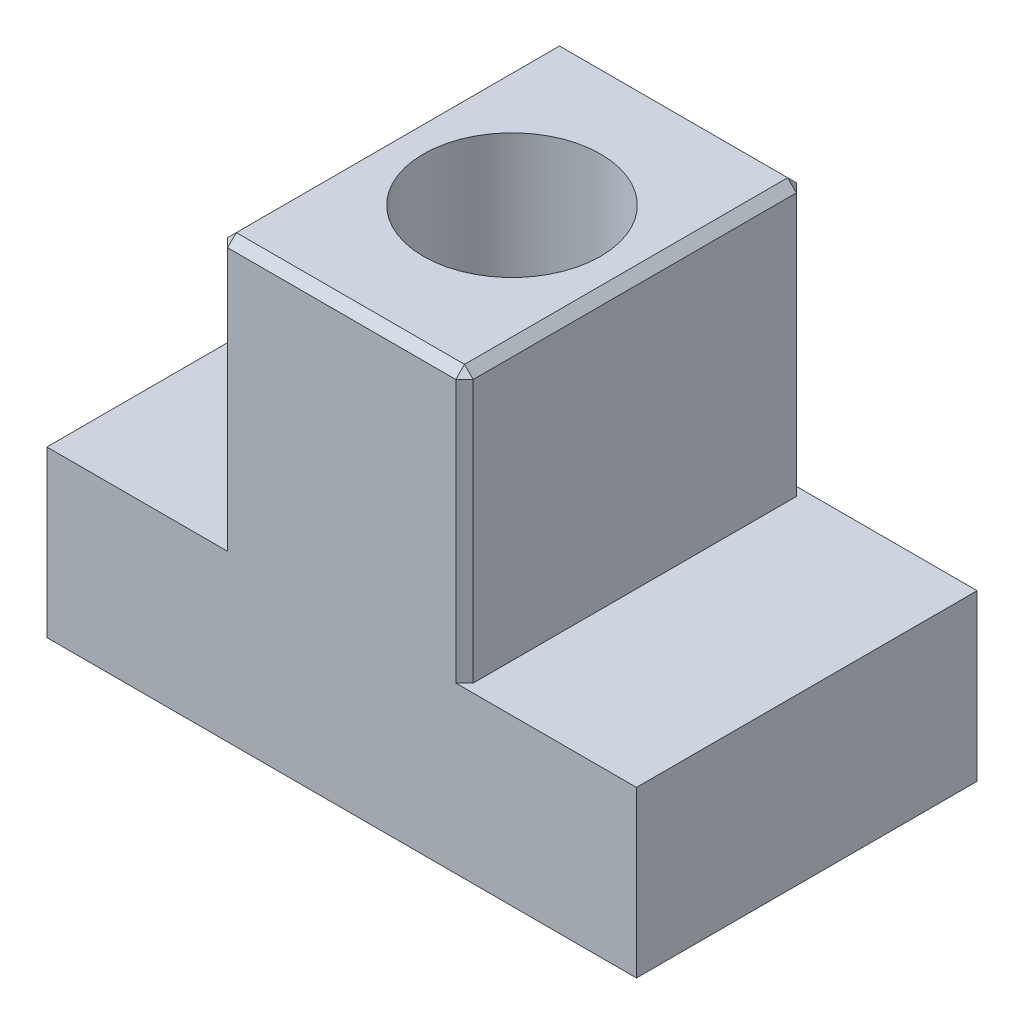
SolidWorks part; units mm, degrees
ref_plane "FRONT" through (0, 0, 0) normal (0, 0, 1) x (1, 0, 0)
ref_plane "TOP" through (0, 0, 0) normal (0, 1, 0) x (1, 0, 0)
ref_plane "SIDE" through (0, 0, 0) normal (1, 0, 0) x (0, 0, -1)
sketch "Sketch1" plane through (0, 0, 0) normal (0, 0, 1) x (1, 0, 0)
  line L0 (-17.145, 0) -> (17.145, 0)
  line L1 (-17.145, 0) -> (-17.145, 9.6012)
  line L2 (-17.145, 9.6012) -> (-7.1437, 9.6012)
  line L3 (-7.1437, 9.6012) -> (-7.1437, 25.4)
  line L4 (-7.1437, 25.4) -> (7.1437, 25.4)
  line L5 (7.1437, 25.4) -> (7.1437, 9.6012)
  line L6 (7.1437, 9.6012) -> (17.145, 9.6012)
  line L7 (17.145, 9.6012) -> (17.145, 0)
  dimension "D1" = 9.6012
  dimension "D2" = 17.145
  dimension "D3" = 17.145
  dimension "D4" = 7.1437
  dimension "D5" = 7.1437
  dimension "D6" = 25.4
extrude "Base-Extrude" add sketch "Sketch1" along normal mid plane 19.812
chamfer "Chamfer1" distance 0.508 angle 45
other "Hole1"
sketch "Sketch2" plane through (0, 25.4, 0) normal (0, 1, 0) x (-1, 0, 0)
  circle A0 centre (0, 0) radius 5.1562
  dimension "D1" = 10.3124
sketch "Sketch3" plane through (0, 0, 0) normal (0, -1, 0) x (1, 0, 0)
  circle A0 centre (0, 0) radius 5.5626
  dimension "D1" = 11.1252
extrude "Cut-Extrude1" cut sketch "Sketch3" against normal blind 6.35
